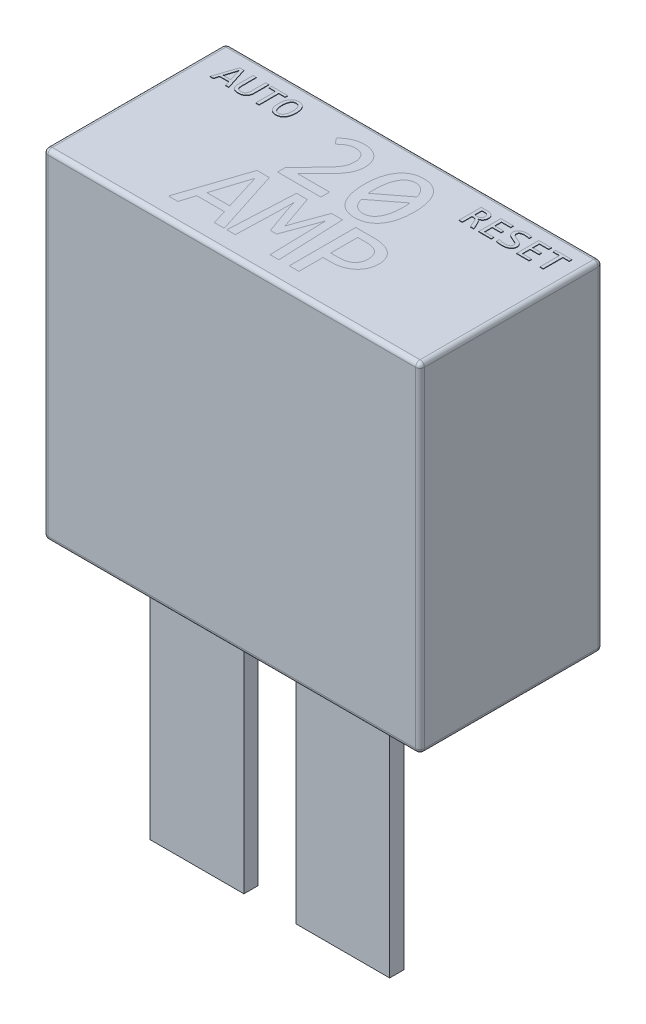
SolidWorks part; units mm, degrees
ref_plane "Front Plane" through (0, 0, 0) normal (0, 0, 1) x (1, 0, 0)
ref_plane "Top Plane" through (0, 0, 0) normal (0, 1, 0) x (1, 0, 0)
ref_plane "Right Plane" through (0, 0, 0) normal (1, 0, 0) x (0, 0, -1)
sketch "Sketch1" plane through (0, 0, 0) normal (0, 1, 0) x (1, 0, 0)
  line L1 (-6.8707, -3.048) -> (-1.4859, -3.048)
  line L2 (-6.8707, -3.048) -> (-6.8707, -2.2352)
  line L3 (-6.8707, -2.2352) -> (-1.4859, -2.2352)
  line L4 (-1.4859, -3.048) -> (-1.4859, -2.2352)
  line L5 (-6.8707, -3.048) -> (-1.4859, -2.2352) construction
  line L6 (-6.8707, -2.2352) -> (-1.4859, -3.048) construction
  line L7 (1.4859, -3.048) -> (6.8707, -3.048)
  line L8 (1.4859, -3.048) -> (1.4859, -2.2352)
  line L9 (1.4859, -2.2352) -> (6.8707, -2.2352)
  line L10 (6.8707, -3.048) -> (6.8707, -2.2352)
  line L11 (1.4859, -3.048) -> (6.8707, -2.2352) construction
  line L12 (1.4859, -2.2352) -> (6.8707, -3.048) construction
  point P0 (-4.1783, -2.6416)
  point P5 (4.1783, -2.6416)
  dimension "D1" = 0.8128
  dimension "D2" = 0.8128
  dimension "D3" = 5.3848
  dimension "D4" = 5.3848
  dimension "D5" = 2.9718
  dimension "D6" = 1.4859
  dimension "D7" = 2.6416
  dimension "D8" = 0
extrude "Boss-Extrude1" add sketch "Sketch1" against normal blind 14.478
chamfer "Chamfer1" distance 0.4064 angle 45 4 edges at (-4.1783, -14.478, 2.2352) (-4.1783, -14.478, 3.048) (-6.8707, -14.478, 2.6416) (-1.4859, -14.478, 2.6416)
chamfer "Chamfer2" distance 0.4064 angle 45 4 edges at (6.8707, -14.478, 2.6416) (4.1783, -14.478, 2.2352) (4.1783, -14.478, 3.048) (1.4859, -14.478, 2.6416)
sketch "Sketch3" plane through (0, 0, 0) normal (0, 1, 0) x (1, 0, 0)
  line L1 (10.795, 5.2324) -> (-10.795, 5.2324)
  line L2 (10.795, 5.2324) -> (10.795, -5.2324)
  line L3 (10.795, -5.2324) -> (-10.795, -5.2324)
  line L4 (-10.795, 5.2324) -> (-10.795, -5.2324)
  line L5 (10.795, 5.2324) -> (-10.795, -5.2324) construction
  line L6 (10.795, -5.2324) -> (-10.795, 5.2324) construction
  point P0 (0, 0)
  dimension "D1" = 10.4648
  dimension "D2" = 21.59
extrude "Boss-Extrude2" add sketch "Sketch3" along normal blind 19.431
fillet "Fillet1" radius 0.254 12 edges at (10.795, 19.431, 0) (0, 19.431, -5.2324) (-10.795, 19.431, 0) (-10.795, 9.7155, 5.2324) (-10.795, 9.7155, -5.2324) (10.795, 9.7155, -5.2324) (-10.795, 0, 0) (0, 0, -5.2324) (10.795, 0, 0) (0, 0, 5.2324) (10.795, 9.7155, 5.2324) (0, 19.431, 5.2324)
sketch "Sketch4" plane through (0, 19.431, 0) normal (0, 1, 0) x (1, 0, 0)
  text T0 "20" font "Consolas" height 3.81
  text T1 "AMP" font "Consolas" height 3.81
  dimension "D1" = 0.254
  dimension "D2" = 4.064
  dimension "D3" = 3.302
  dimension "D4" = 4.826
extrude "Cut-Extrude1" cut sketch "Sketch4" against normal blind 0.0254
sketch "Sketch5" plane through (0, 19.431, 0) normal (0, 1, 0) x (1, 0, 0)
  text T0 "20" font "Consolas" height 3.81
  text T1 "AMP" font "Consolas" height 3.81
  dimension "D1" = 0.254
  dimension "D2" = 3.302
  dimension "D3" = 4.064
  dimension "D4" = 4.826
extrude "Boss-Extrude3" add sketch "Sketch5" against normal blind 0.0254 separate body
sketch "Sketch7" plane through (0, 19.431, 0) normal (0, 1, 0) x (1, 0, 0)
  text T0 "AUTO         RESET" font "Consolas" height 1.27
  dimension "D1" = 9.525
  dimension "D2" = 3.048
extrude "Cut-Extrude2" cut sketch "Sketch7" against normal blind 0.0254
sketch "Sketch8" plane through (0, 19.431, 0) normal (0, 1, 0) x (1, 0, 0)
  text T0 "AUTO         RESET" font "Consolas" height 1.27
  dimension "D1" = 3.048
  dimension "D2" = 9.525
extrude "Boss-Extrude4" add sketch "Sketch8" along normal blind 0.0254 separate body
